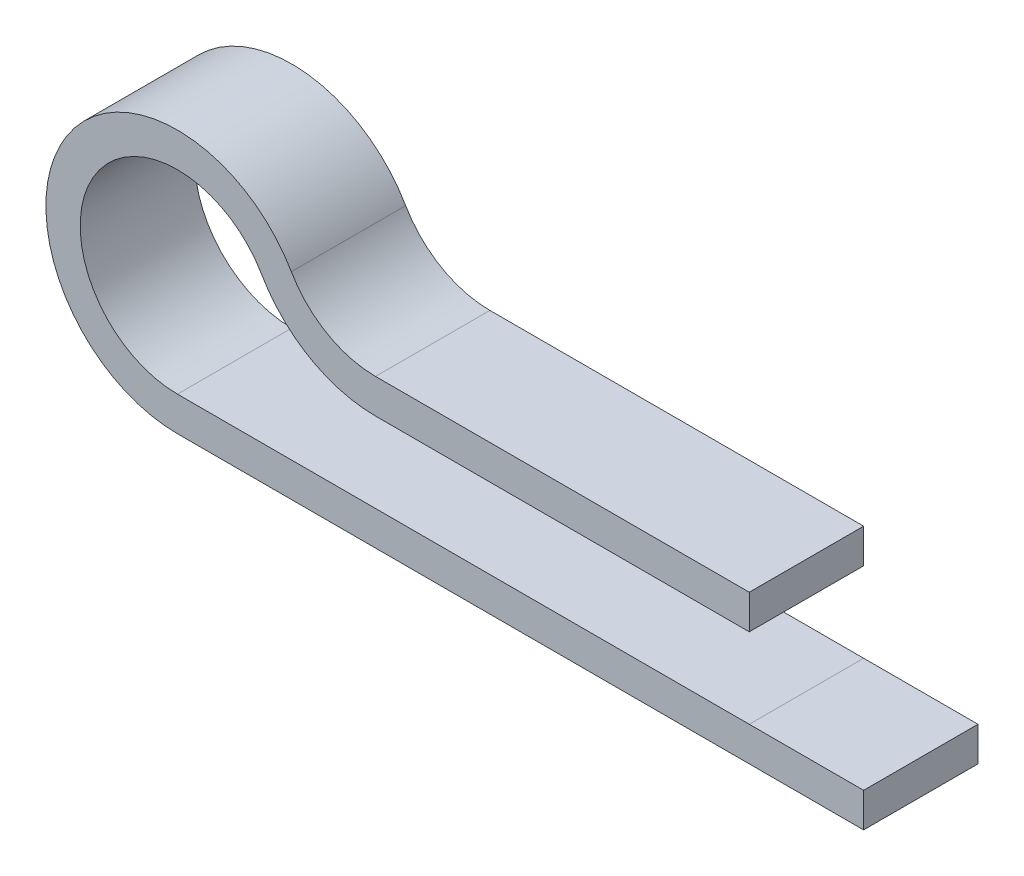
SolidWorks part; units mm, degrees
ref_plane "Front" through (0, 0, 0) normal (0, 0, 1) x (1, 0, 0)
ref_plane "Top" through (0, 0, 0) normal (0, 1, 0) x (1, 0, 0)
ref_plane "Right" through (0, 0, 0) normal (1, 0, 0) x (0, 0, -1)
sketch "Sketch1" plane through (0, 0, 0) normal (0, 0, 1) x (1, 0, 0)
  line L0 (0, 0) -> (30, 0)
  line L1 (8.6603, 5) -> (25, 5)
  line L3 (30, -44.9382) -> (30, 41.6134) construction
  line L5 (25, 41.6134) -> (25, -44.9382) construction
  arc A0 (4.3301, 7.5) -> (0, 0) centre (0, 5) ccw
  arc A1 (4.3301, 7.5) -> (8.6603, 5) centre (8.6603, 10) ccw
  dimension "D1" = 10
  dimension "D2" = 5
  dimension "D3" = 30
  dimension "D4" = 5
ref_plane "Plane1" through (30, 0, 0) normal (1, 0, 0) x (0, 0, -1)
sketch "Sketch2" plane through (30, 0, 0) normal (1, 0, 0) x (0, 0, -1)
  line L0 (-106.2603, 0) -> (108.8076, 0) construction
  line L1 (0, -44.9382) -> (0, 114.9253) construction
  line L2 (0, -44.9382) -> (0, 41.6134) construction
  line L4 (-2.5, 0.75) -> (2.5, 0.75)
  line L5 (-2.5, 0.75) -> (-2.5, -0.75)
  line L6 (-2.5, -0.75) -> (2.5, -0.75)
  line L7 (2.5, 0.75) -> (2.5, -0.75)
  dimension "D1" = 5
  dimension "D2" = 2.5
  dimension "D3" = 1.5
  dimension "D4" = 0.75
sweep "Base-Sweep" add profiles "Sketch2" path "Sketch1"
sketch "Sketch3" plane through (0, -0.75, 0) normal (0, -1, 0) x (1, 0, 0)
  line L0 (25, 2.5) -> (25, -2.5)
  line L1 (30, 2.5) -> (30, -2.5) construction
  line L2 (0, 2.5) -> (30, 2.5) construction
  line L3 (0, -2.5) -> (30, -2.5) construction
  dimension "D1" = 5
